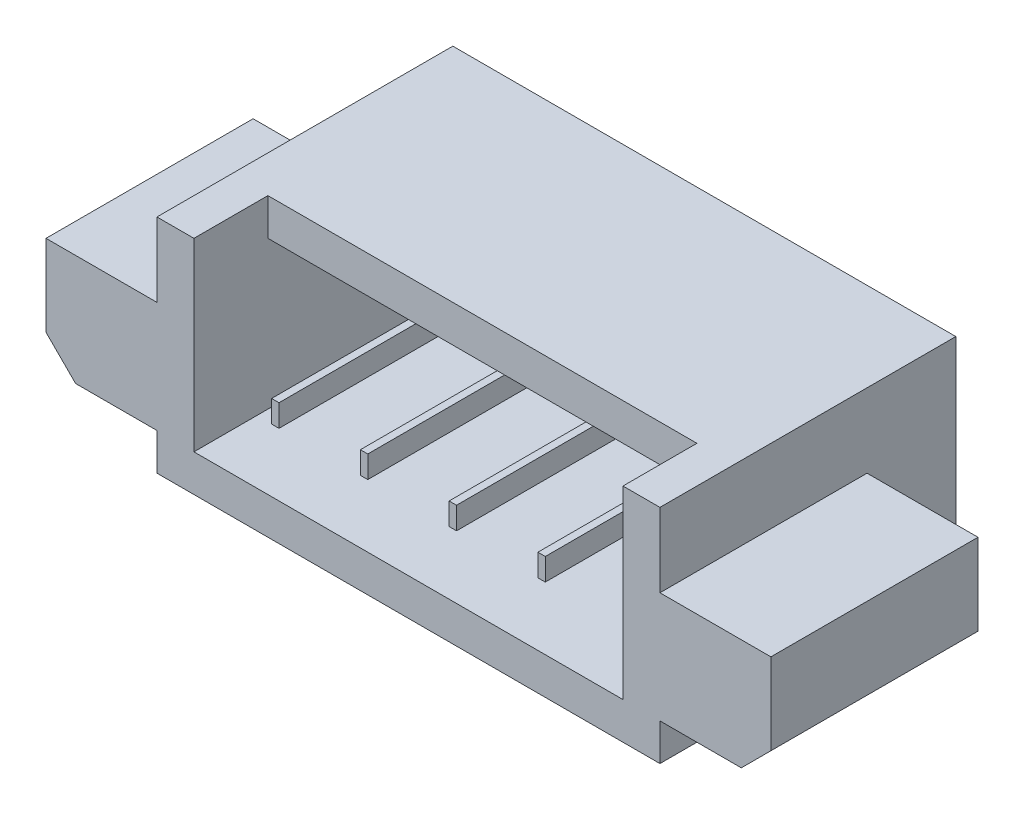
SolidWorks part; units mm, degrees
ref_plane "前视基准面" through (0, 0, 0) normal (0, 0, 1) x (1, 0, 0)
ref_plane "上视基准面" through (0, 0, 0) normal (0, 1, 0) x (1, 0, 0)
ref_plane "右视基准面" through (0, 0, 0) normal (1, 0, 0) x (0, 0, -1)
sketch "草图1" plane through (0, 0, 0) normal (0, 0, 1) x (1, 0, 0)
  line L0 (-2.9, -1) -> (2.9, -1)
  line L1 (-3.4, 1.5) -> (3.4, 1.5)
  line L2 (-3.4, 1.5) -> (-3.4, -1.5)
  line L3 (-3.4, -1.5) -> (3.4, -1.5)
  line L4 (3.4, 1.5) -> (3.4, -1.5)
  line L5 (-3.4, 1.5) -> (3.4, -1.5) construction
  line L6 (-3.4, -1.5) -> (3.4, 1.5) construction
  line L7 (2.9, 1) -> (2.9, -1)
  line L8 (-2.9, 1) -> (2.9, 1)
  line L9 (-2.9, 1) -> (-2.9, -1)
  point P0 (0, 0)
  dimension "D1" = 6.8
  dimension "D2" = 3
  dimension "D3" = 0.5
extrude "凸台-拉伸1" add sketch "草图1" along normal blind 4
sketch "草图2" plane through (0, 0, 4) normal (0, 0, 1) x (1, 0, 0)
  line L0 (0, 2.8403) -> (0, -3.2921) construction
  line L1 (-3.4, 1.5) -> (-3.4, -1.5) construction
  line L2 (-3.4, -1) -> (-4.5, -1)
  line L3 (-3.4, -1) -> (-3.4, 0.5)
  line L4 (-3.4, 0.5) -> (-4.9, 0.5)
  line L5 (-4.9, -0.6) -> (-4.9, 0.5)
  line L6 (-3.4, -1.5) -> (3.4, -1.5) construction
  line L7 (3.4, -1) -> (3.4, 0.5)
  line L8 (3.4, 0.5) -> (4.9, 0.5)
  line L9 (4.9, -0.6) -> (4.9, 0.5)
  line L10 (3.4, -1) -> (4.5, -1)
  line L11 (-4.5, -1) -> (-4.9, -0.6)
  line L12 (4.5, -1) -> (4.9, -0.6)
  point P6 (-4.9, -1)
  point P14 (4.9, -1)
  dimension "D1" = 1.5
  dimension "D2" = 0.5
  dimension "D3" = 1.5
extrude "凸台-拉伸2" add sketch "草图2" against normal blind 2.8
sketch "草图3" plane through (0, 0, 0) normal (0, 0, -1) x (-1, 0, 0)
  line L1 (3.4, -1.5) -> (-3.4, -1.5)
  line L2 (3.4, -1.5) -> (3.4, 1.5)
  line L3 (3.4, 1.5) -> (-3.4, 1.5)
  line L4 (-3.4, -1.5) -> (-3.4, 1.5)
extrude "凸台-拉伸3" add sketch "草图3" against normal blind 0.5
sketch "草图5" plane through (0, 1.5, 0) normal (0, 1, 0) x (1, 0, 0)
  line L0 (3.4, -4) -> (-3.4, -4) construction
  line L1 (-2.9, -4) -> (2.9, -4)
  line L2 (-2.9, -4) -> (-2.9, -3)
  line L3 (-2.9, -3) -> (2.9, -3)
  line L4 (2.9, -4) -> (2.9, -3)
  line L5 (-3.4, -4) -> (-3.4, 0) construction
  line L6 (3.4, -4) -> (3.4, 0) construction
  dimension "D1" = 0.5
  dimension "D2" = 0.5
  dimension "D3" = 1
extrude "切除-拉伸1" cut sketch "草图5" against normal blind 0.5
sketch "草图6" plane through (0, 0, 0.5) normal (0, 0, 1) x (1, 0, 0)
  line L0 (-6.6592, 0) -> (5.8992, 0) construction
  line L1 (0, 2.7397) -> (0, -3.375) construction
  line L2 (-0.65, 0.15) -> (-0.65, -0.15)
  line L3 (-1.85, 0.15) -> (-1.75, 0.15)
  line L4 (-1.85, 0.15) -> (-1.85, -0.15)
  line L5 (-1.85, -0.15) -> (-1.75, -0.15)
  line L6 (-1.75, 0.15) -> (-1.75, -0.15)
  line L7 (-1.85, 0.15) -> (-1.75, -0.15) construction
  line L8 (-1.85, -0.15) -> (-1.75, 0.15) construction
  line L9 (-0.65, 0.15) -> (-0.55, 0.15)
  line L10 (-0.55, 0.15) -> (-0.55, -0.15)
  line L11 (-0.65, -0.15) -> (-0.55, -0.15)
  line L12 (0.55, 0.15) -> (0.55, -0.15)
  line L13 (0.55, 0.15) -> (0.65, 0.15)
  line L14 (0.65, 0.15) -> (0.65, -0.15)
  line L15 (0.55, -0.15) -> (0.65, -0.15)
  line L16 (1.75, 0.15) -> (1.75, -0.15)
  line L17 (1.75, 0.15) -> (1.85, 0.15)
  line L18 (1.85, 0.15) -> (1.85, -0.15)
  line L19 (1.75, -0.15) -> (1.85, -0.15)
  line L20 (2.95, 0.15) -> (2.95, -0.15)
  line L21 (2.95, 0.15) -> (3.05, 0.15)
  line L22 (3.05, 0.15) -> (3.05, -0.15)
  line L23 (2.95, -0.15) -> (3.05, -0.15)
  line L24 (-2.9, 1.5) -> (-2.9, -1) construction
  point P5 (-1.8, 0)
  point P28 (-2.9, 0.25)
  dimension "D1" = 0.1
  dimension "D2" = 0.3
  dimension "D4" = 1.05
  dimension "D3" = 5
extrude "凸台-拉伸4" add sketch "草图6" along normal up to vertex (3.5 mm away)
